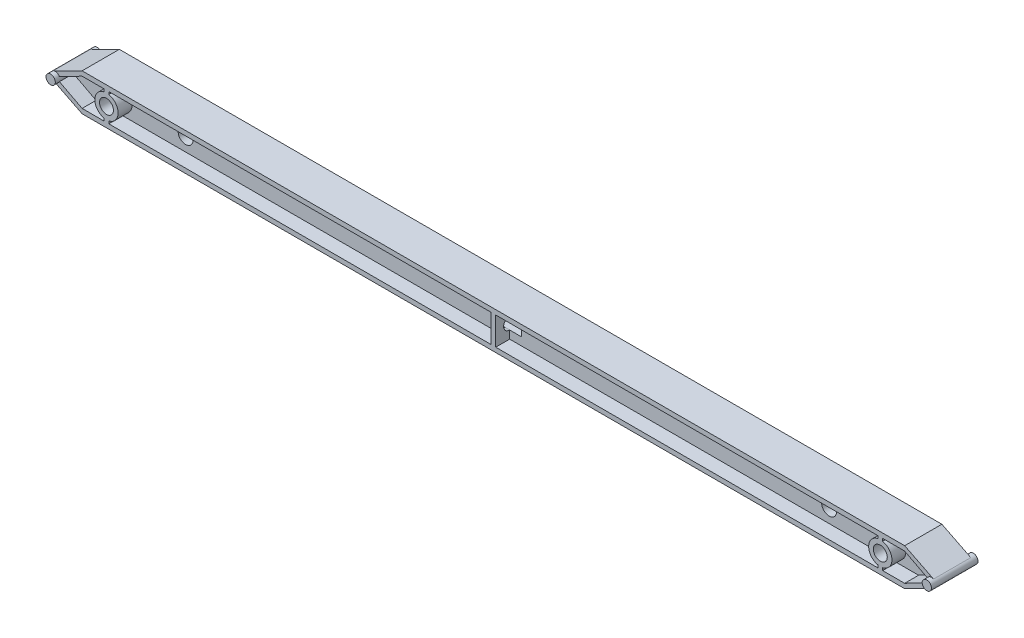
SolidWorks part; units mm, degrees
ref_plane "Front Plane" through (0, 0, 0) normal (0, 0, 1) x (1, 0, 0)
ref_plane "Top Plane" through (0, 0, 0) normal (0, 1, 0) x (1, 0, 0)
ref_plane "Right Plane" through (0, 0, 0) normal (1, 0, 0) x (0, 0, -1)
sketch "Sketch1" plane through (0, 0, 0) normal (0, 0, 1) x (1, 0, 0)
  line L0 (-74.6332, 0) -> (170.2126, 0)
  line L1 (-64.4732, -5.08) -> (-64.4732, 5.08)
  line L2 (-74.6332, 0) -> (-64.4732, 5.08)
  line L3 (-74.6332, 0) -> (-64.4732, -5.08)
  line L4 (160.0526, -5.08) -> (160.0526, 5.08)
  line L5 (160.0526, 5.08) -> (170.2126, 0)
  line L6 (160.0526, -5.08) -> (170.2126, 0)
  line L7 (-64.4732, 5.08) -> (160.0526, 5.08)
  line L8 (-64.4732, -5.08) -> (160.0526, -5.08)
  point P6 (-64.4732, 0)
  point P9 (160.0526, 0)
  dimension "D1" = 244.8458
  dimension "D2" = 90
  dimension "D3" = 10.16
  dimension "D4" = 10.16
  dimension "D5" = 90
  dimension "D6" = 10.16
  dimension "D7" = 10.16
extrude "Boss-Extrude3" add sketch "Sketch1" along normal blind 10.16 contours L2 L0 L1 | L0 L3 L1 | L7 L1 L0 L4 | L1 L8 L4 L0 | L4 L6 L0 | L5 L4 L0
sketch "Sketch4" plane through (0, 0, 10.16) normal (0, 0, 1) x (1, 0, 0)
  line L0 (-74.6332, 0) -> (-64.4732, -5.08) construction
  line L1 (-74.6332, 0) -> (-64.4732, 5.08) construction
  line L2 (160.0526, -5.08) -> (170.2126, 0) construction
  line L3 (160.0526, 5.08) -> (170.2126, 0) construction
  line L4 (160.0526, 5.08) -> (160.0526, 3.81)
  line L5 (160.0526, -5.08) -> (160.0526, -3.81)
  line L6 (160.0526, 3.81) -> (166.2463, 0.5863)
  line L7 (160.0526, -3.81) -> (166.2463, -0.5863)
  line L8 (-64.4732, 5.08) -> (-64.4732, 3.81)
  line L9 (-64.4732, -5.08) -> (-64.4732, -3.81)
  line L10 (-64.4732, 3.81) -> (-70.6668, 0.5863)
  line L11 (-64.4732, -3.81) -> (-70.6668, -0.5863)
  line L12 (-64.4732, -3.81) -> (160.0526, -3.81)
  line L13 (160.0526, 3.81) -> (-64.4732, 3.81)
  circle A0 centre (-71.7934, 0) radius 1.27
  circle A1 centre (167.3728, 0) radius 1.27
  dimension "D1" = 2.54
  dimension "D2" = 2.54
  dimension "D3" = 1.27
  dimension "D4" = 1.27
  dimension "D5" = 1.27
  dimension "D6" = 1.27
extrude "Cut-Extrude1" cut sketch "Sketch4" against normal blind 3.81 contours A1 L6 L13 L10 A0 L11 L12 L7
sketch "Sketch6" plane through (0, 0, 10.16) normal (0, 0, 1) x (1, 0, 0)
  line L0 (160.0526, -5.08) -> (170.2126, 0) construction
  line L1 (160.0526, 5.08) -> (170.2126, 0) construction
  line L2 (-74.6332, 0) -> (-64.4732, -5.08) construction
  line L3 (-74.6332, 0) -> (-64.4732, 5.08) construction
  circle A0 centre (-71.7934, 0) radius 1.27
  circle A1 centre (167.3728, 0) radius 1.27
  dimension "D1" = 2.54
  dimension "D2" = 2.54
extrude "Boss-Extrude4" add sketch "Sketch6" along normal blind 1.27
sketch "Sketch7" plane through (0, 0, 10.16) normal (0, 0, 1) x (1, 0, 0)
  line L0 (170.2126, 0) -> (167.9408, 1.1359) construction
  line L1 (167.9408, -1.1359) -> (170.2126, 0) construction
  line L2 (-72.3613, 1.1359) -> (-74.6332, 0) construction
  line L3 (-74.6332, 0) -> (-72.3613, -1.1359) construction
  line L4 (170.2126, 0) -> (167.9408, 1.1359)
  line L5 (167.9408, -1.1359) -> (170.2126, 0)
  line L6 (-72.3613, 1.1359) -> (-74.6332, 0)
  line L7 (-74.6332, 0) -> (-72.3613, -1.1359)
  arc A0 (167.9408, -1.1359) -> (167.9408, 1.1359) centre (167.3728, 0) ccw construction
  arc A1 (-72.3613, 1.1359) -> (-72.3613, -1.1359) centre (-71.7934, 0) ccw construction
  arc A2 (167.9408, -1.1359) -> (167.9408, 1.1359) centre (167.3728, 0) ccw
  arc A3 (-72.3613, 1.1359) -> (-72.3613, -1.1359) centre (-71.7934, 0) ccw
extrude "Cut-Extrude2" cut sketch "Sketch7" against normal through all
sketch "Sketch9" plane through (0, 0, 0) normal (0, 0, -1) x (-1, 0, 0)
  circle A0 centre (-167.3728, 0) radius 1.27
  circle A1 centre (71.7934, 0) radius 1.27
  arc A2 (72.3613, -1.1359) -> (72.3613, 1.1359) centre (71.7934, 0) ccw construction
  arc A3 (-167.9408, 1.1359) -> (-167.9408, -1.1359) centre (-167.3728, 0) ccw construction
  dimension "D1" = 2.54
  dimension "D2" = 2.54
extrude "Boss-Extrude5" add sketch "Sketch9" along normal blind 1.27
sketch "Sketch10" plane through (0, 0, 0) normal (0, 0, -1) x (-1, 0, 0)
  line L0 (-160.0526, 5.08) -> (-160.0526, 3.81)
  line L1 (-160.0526, -5.08) -> (-160.0526, -3.81)
  line L2 (-160.0526, 3.81) -> (-166.1028, 0)
  line L3 (-160.0526, -3.81) -> (-166.1028, 0)
  line L4 (64.4732, 5.08) -> (64.4732, 3.81)
  line L5 (64.4732, -5.08) -> (64.4732, -3.81)
  line L6 (64.4732, -3.81) -> (70.6668, -0.5863)
  line L7 (64.4732, 3.81) -> (70.6668, 0.5863)
  line L8 (64.4732, -3.81) -> (-160.0526, -3.81)
  line L9 (-160.0526, 3.81) -> (64.4732, 3.81)
  arc A0 (-167.9408, -1.1359) -> (-167.9408, 1.1359) centre (-167.3728, 0) ccw construction
  arc A1 (72.3613, 1.1359) -> (72.3613, -1.1359) centre (71.7934, 0) ccw construction
  circle A2 centre (71.7934, 0) radius 1.27 construction
  dimension "D1" = 1.27
  dimension "D2" = 1.27
  dimension "D3" = 1.27
  dimension "D4" = 1.27
extrude "Cut-Extrude3" cut sketch "Sketch10" against normal blind 3.81 contours L9 L2 L3 L8 L6 L7 M9 M5
sketch "Sketch11" plane through (0, 0, 6.35) normal (0, 0, 1) x (1, 0, 0)
  line L0 (-73.0634, 0) -> (-57.8234, 0)
  line L1 (-57.8234, 0) -> (-40.0434, 0)
  line L2 (168.6428, 0) -> (153.4028, 0)
  line L3 (153.4028, 0) -> (135.6228, 0)
  line L4 (-38.0114, 0) -> (133.5908, 0)
  line L5 (43.9797, 1.651) -> (43.9797, -1.651)
  line L6 (43.9797, 1.651) -> (51.5997, 1.651)
  line L7 (43.9797, -1.651) -> (51.5997, -1.651)
  line L8 (51.5997, 1.651) -> (51.5997, -1.651)
  line L9 (43.9797, 1.651) -> (51.5997, -1.651) construction
  line L10 (43.9797, -1.651) -> (51.5997, 1.651) construction
  circle A0 centre (-71.7934, 0) radius 1.27 construction
  circle A1 centre (-57.8234, 0) radius 1.905
  circle A2 centre (-40.0434, 0) radius 2.032
  circle A3 centre (167.3728, 0) radius 1.27 construction
  circle A4 centre (153.4028, 0) radius 1.905
  circle A5 centre (135.6228, 0) radius 2.032
  point P19 (47.7897, 0)
  point P21 (47.7897, 0)
  dimension "D2" = 3.81
  dimension "D4" = 4.064
  dimension "D7" = 3.81
  dimension "D8" = 4.064
  dimension "D1" = 15.24
  dimension "D3" = 17.78
  dimension "D5" = 15.24
  dimension "D6" = 17.78
  dimension "D9" = 7.62
  dimension "D10" = 3.302
extrude "Cut-Extrude5" cut sketch "Sketch11" against normal through all
sketch "Sketch12" plane through (0, 0, 6.35) normal (0, 0, 1) x (1, 0, 0)
  line L0 (-58.4584, 3.81) -> (-58.4584, -3.81)
  line L1 (-58.4584, 3.81) -> (-57.1884, 3.81)
  line L2 (-58.4584, -3.81) -> (-57.1884, -3.81)
  line L3 (-57.1884, 3.81) -> (-57.1884, -3.81)
  line L4 (-58.4584, 3.81) -> (-57.1884, -3.81) construction
  line L5 (-58.4584, -3.81) -> (-57.1884, 3.81) construction
  line L6 (-71.7934, 0) -> (167.3728, 0) construction
  line L9 (47.1547, 3.81) -> (47.1547, -3.81)
  line L10 (47.1547, 3.81) -> (48.4247, 3.81)
  line L11 (47.1547, -3.81) -> (48.4247, -3.81)
  line L12 (48.4247, 3.81) -> (48.4247, -3.81)
  line L13 (47.1547, 3.81) -> (48.4247, -3.81) construction
  line L14 (47.1547, -3.81) -> (48.4247, 3.81) construction
  line L15 (152.7678, 3.81) -> (152.7678, -3.81)
  line L16 (152.7678, 3.81) -> (154.0378, 3.81)
  line L17 (152.7678, -3.81) -> (154.0378, -3.81)
  line L18 (154.0378, 3.81) -> (154.0378, -3.81)
  line L19 (152.7678, 3.81) -> (154.0378, -3.81) construction
  line L20 (152.7678, -3.81) -> (154.0378, 3.81) construction
  circle A0 centre (-57.8234, 0) radius 3.175
  circle A1 centre (-57.8234, 0) radius 1.905 construction
  circle A2 centre (153.4028, 0) radius 3.175
  circle A3 centre (153.4028, 0) radius 1.905 construction
  point P12 (47.7897, 0)
  point P16 (47.7897, 0)
  dimension "D1" = 1.27
  dimension "D4" = 1.27
  dimension "D2" = 1.27
  dimension "D3" = 1.27
  dimension "D5" = 1.27
extrude "Boss-Extrude6" add sketch "Sketch12" along normal blind 3.81
sketch "Sketch13" plane through (47.1547, 0, 0) normal (-1, 0, 0) x (0, 0, 1)
  line L0 (6.35, 1.651) -> (6.35, -1.651) construction
  circle A0 centre (6.35, 0) radius 1.651
extrude "Cut-Extrude6" cut sketch "Sketch13" against normal blind 3.81
sketch "Sketch14" plane through (0, 0, 3.81) normal (0, 0, -1) x (-1, 0, 0)
  line L0 (-154.0378, 3.81) -> (-154.0378, -3.81)
  line L1 (-154.0378, 3.81) -> (-152.7678, 3.81)
  line L2 (-154.0378, -3.81) -> (-152.7678, -3.81)
  line L3 (-152.7678, 3.81) -> (-152.7678, -3.81)
  line L4 (-154.0378, 3.81) -> (-152.7678, -3.81) construction
  line L5 (-154.0378, -3.81) -> (-152.7678, 3.81) construction
  line L6 (57.1884, 3.81) -> (57.1884, -3.81)
  line L7 (57.1884, 3.81) -> (58.4584, 3.81)
  line L8 (57.1884, -3.81) -> (58.4584, -3.81)
  line L9 (58.4584, 3.81) -> (58.4584, -3.81)
  line L10 (57.1884, 3.81) -> (58.4584, -3.81) construction
  line L11 (57.1884, -3.81) -> (58.4584, 3.81) construction
  circle A0 centre (-153.4028, 0) radius 3.175
  circle A1 centre (-153.4028, 0) radius 1.905 construction
  circle A2 centre (57.8234, 0) radius 3.175
  circle A3 centre (57.8234, 0) radius 1.905 construction
  dimension "D1" = 1.27
  dimension "D3" = 1.27
  dimension "D2" = 1.27
  dimension "D4" = 1.27
extrude "Boss-Extrude7" add sketch "Sketch14" along normal blind 3.81 contours A2 L9 L6 M7 | L9 A2 L6 M6 | L6 A2 M6 | L9 A2 M6 | L6 A2 L9 M6 | A2 L6 L9 M11 | A0 L3 L0 M7 | L3 A0 L0 M3 | L0 A0 M3 | L0 A0 L3 M3 | A0 L0 L3 M11 | L3 A0 M3
